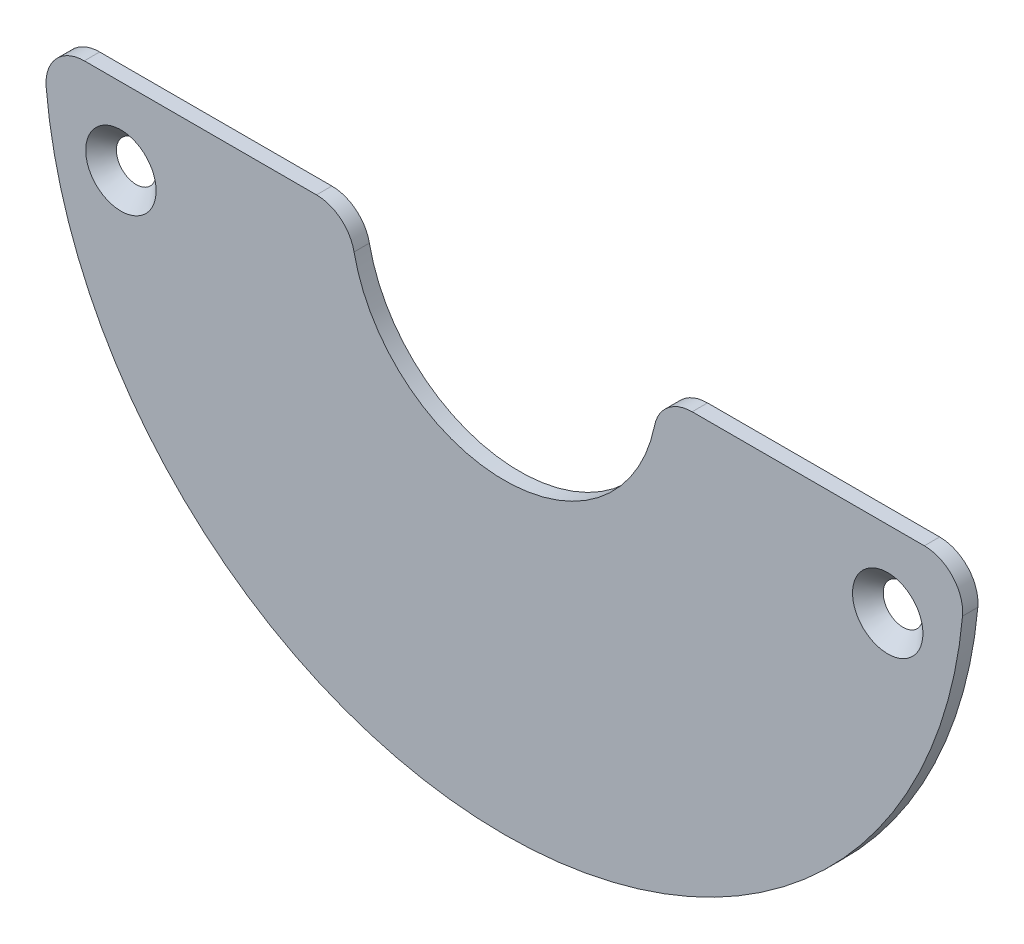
SolidWorks part; units mm, degrees
ref_plane "Ebene vorne" through (0, 0, 0) normal (0, 0, 1) x (1, 0, 0)
ref_plane "Ebene oben" through (0, 0, 0) normal (0, 1, 0) x (1, 0, 0)
ref_plane "Ebene rechts" through (0, 0, 0) normal (1, 0, 0) x (0, 0, -1)
sketch "Skizze1" plane through (0, 0, 0) normal (0, 0, 1) x (1, 0, 0)
  line L0 (-54.7723, 0) -> (-24.4949, 0)
  line L1 (24.4949, 0) -> (54.7723, 0)
  line L2 (-72.3638, -60) -> (86.1532, -60) construction
  arc A0 (-59.7516, -5.4545) -> (59.7516, -5.4545) centre (0, 0) ccw
  arc A1 (-19.5959, -4) -> (19.5959, -4) centre (0, 0) ccw
  arc A2 (-54.7723, 0) -> (-59.7516, -5.4545) centre (-54.7723, -5) ccw
  arc A3 (-19.5959, -4) -> (-24.4949, 0) centre (-24.4949, -5) ccw
  arc A4 (24.4949, 0) -> (19.5959, -4) centre (24.4949, -5) ccw
  arc A5 (59.7516, -5.4545) -> (54.7723, 0) centre (54.7723, -5) ccw
  dimension "D1" = 60
  dimension "D2" = 20
  dimension "D3" = 10
  dimension "D4" = 10
  dimension "D5" = 10
  dimension "D6" = 10
  dimension "D7" = 60
extrude "Aufsatz-Linear austragen1" add sketch "Skizze1" along normal blind 2
hole_wizard "Formsenkung für M4 Senkschraube mit Innensechskant1" positions "Skizze3" profile "Skizze2" countersink size "M4" standard "DIN"
sketch "Skizze3" plane through (0, 0, 2) normal (0, 0, 1) x (1, 0, 0)
  line L1 (-24.4949, 0) -> (-54.7723, 0) construction
  line L2 (54.7723, 0) -> (24.4949, 0) construction
  arc A0 (-19.5959, -4) -> (19.5959, -4) centre (0, 0) ccw construction
  point P0 (-50, -10)
  point P1 (50, -10)
  dimension "D1" = 100
  dimension "D2" = 50
  dimension "D3" = 10
  dimension "D4" = 10
sketch "Skizze2" plane through (-50, -10, 2) normal (1, 0, 0) x (0, -1, 0)
  line L0 (0, 0) -> (0, 2)
  line L1 (0, 2) -> (2.25, 2)
  line L2 (2.25, 2) -> (2.25, 2.34)
  line L3 (2.25, 2.34) -> (4.59, 0)
  line L5 (4.59, 0) -> (0, 0)
  line L6 (-2.25, 2.34) -> (-4.59, 0) construction
  line L11 (0, -6.35) -> (0, 107.95) construction
  dimension "Bohrerdurchmesser" = 4.5
  dimension "Bohrungstiefe" = 2
  dimension "Senkdurchmesser (Oben)" = 9.18
  dimension "Senkwinkel (Oben)" = 90
